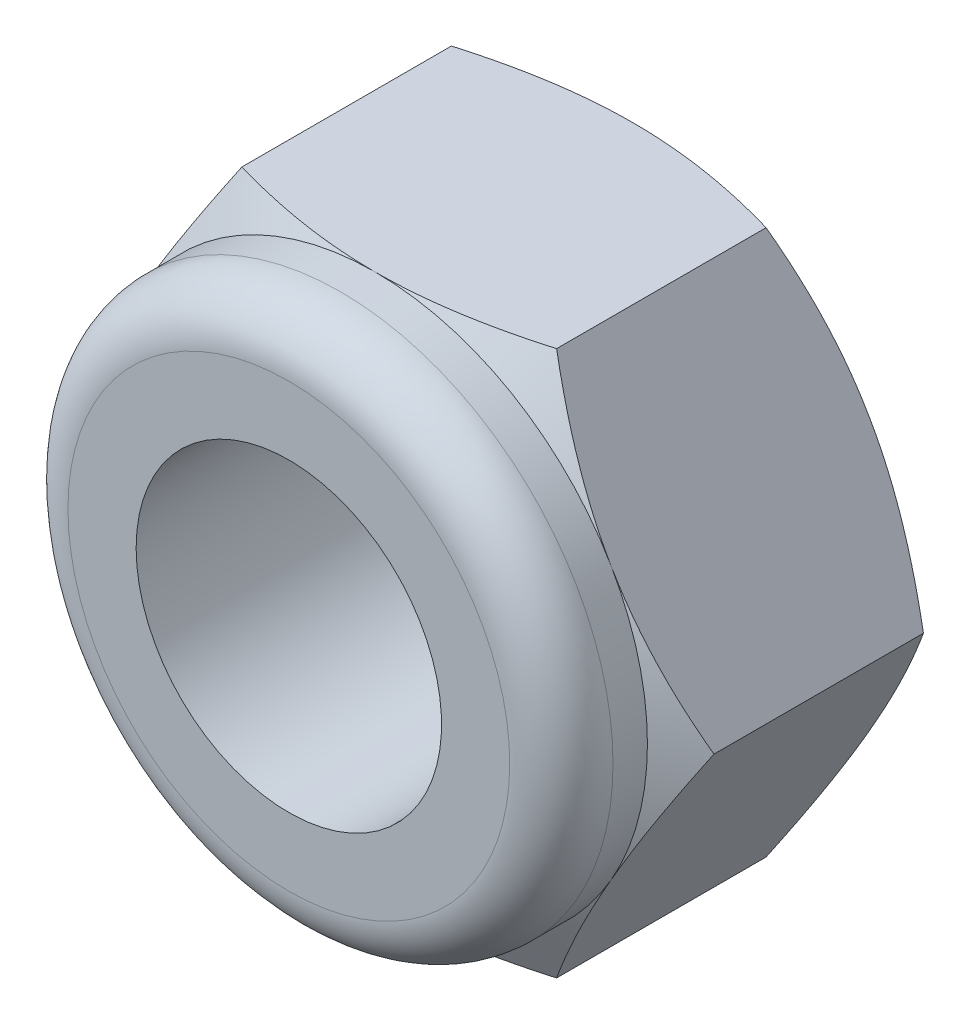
SolidWorks part; units mm, degrees
ref_plane "Plan de face" through (0, 0, 0) normal (0, 0, 1) x (1, 0, 0)
ref_plane "Plan de dessus" through (0, 0, 0) normal (0, 1, 0) x (1, 0, 0)
ref_plane "Plan de droite" through (0, 0, 0) normal (1, 0, 0) x (0, 0, -1)
imported_body "Importée3"
sketch "Esquisse1" plane through (0, 0, 0) normal (0, 0, 1) x (1, 0, 0)
  circle A0 centre (0, 0) radius 9.5
extrude "Boss.-Extru.1" add sketch "Esquisse1" along normal blind 3
hole_wizard "Dégagement M101" positions "Esquisse3" profile "Esquisse2" hole size "M10" standard "Ansi Metric"
sketch "Esquisse3" plane through (0, 0, -9) normal (0, 0, -1) x (-1, 0, 0)
  point P0 (0, 0)
sketch "Esquisse2" plane through (0, 0, -9) normal (1, 0, 0) x (0, 1, 0)
  line L0 (0, 0) -> (0, 12)
  line L1 (0, 12) -> (5.3234, 12)
  line L2 (5.3234, 12) -> (5.3234, 0)
  line L5 (5.3234, 0) -> (0, 0)
  line L11 (0, -6.35) -> (0, 107.95) construction
  dimension "Diamètre du perçage jusqu'au prochain" = 10.6469
  dimension "Profondeur du perçage jusqu'au prochain" = 12
fillet "Congé1" radius 1.8 1 edges at (9.5, 0, 3)
